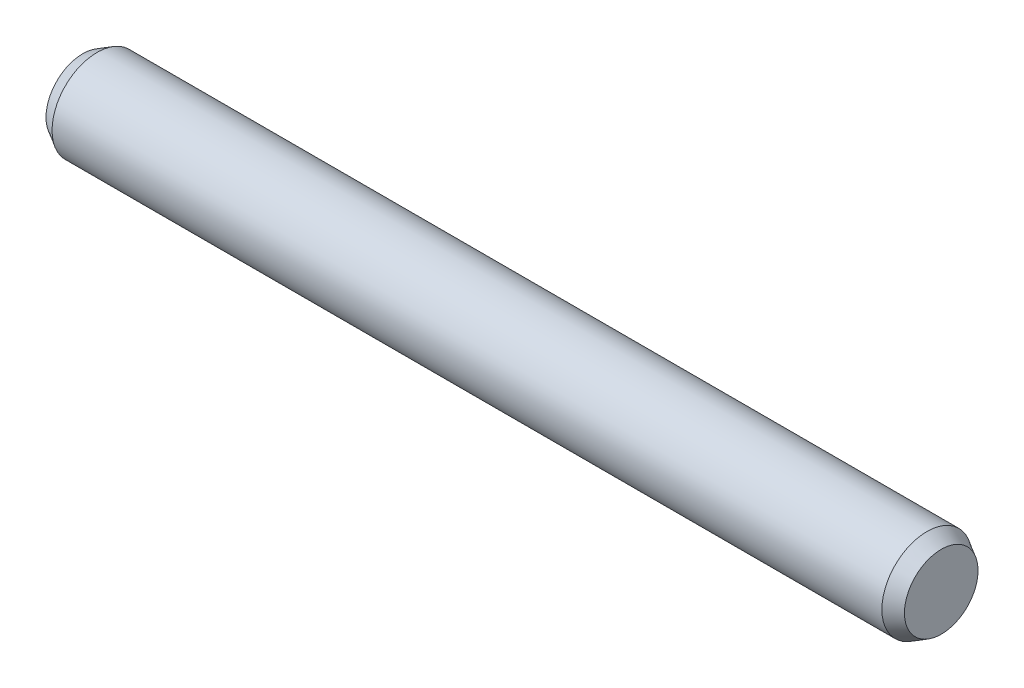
SolidWorks part; units mm, degrees
ref_plane "Front Plane" through (0, 0, 0) normal (0, 0, 1) x (1, 0, 0)
ref_plane "Top Plane" through (0, 0, 0) normal (0, 1, 0) x (1, 0, 0)
ref_plane "Right Plane" through (0, 0, 0) normal (1, 0, 0) x (0, 0, -1)
sketch "Sketch1" plane through (0, 0, 0) normal (0, 0, 1) x (1, 0, 0)
  line L0 (0, 0) -> (15.24, 0)
  line L1 (15.24, 0) -> (15.24, 0.6534)
  line L2 (14.986, 0.8) -> (0.254, 0.8)
  line L3 (0, 0.6534) -> (0, 0)
  line L4 (14.986, 0.8) -> (15.24, 0.6534)
  line L5 (7.62, 0) -> (7.62, 0.8) construction
  line L6 (0.254, 0.8) -> (0, 0.6534)
  dimension "D1" = 15.24
  dimension "D2" = 0.8
  dimension "D3" = 30
  dimension "D4" = 0.254
revolve "Revolve1" add sketch "Sketch1" angle 360 about L0
